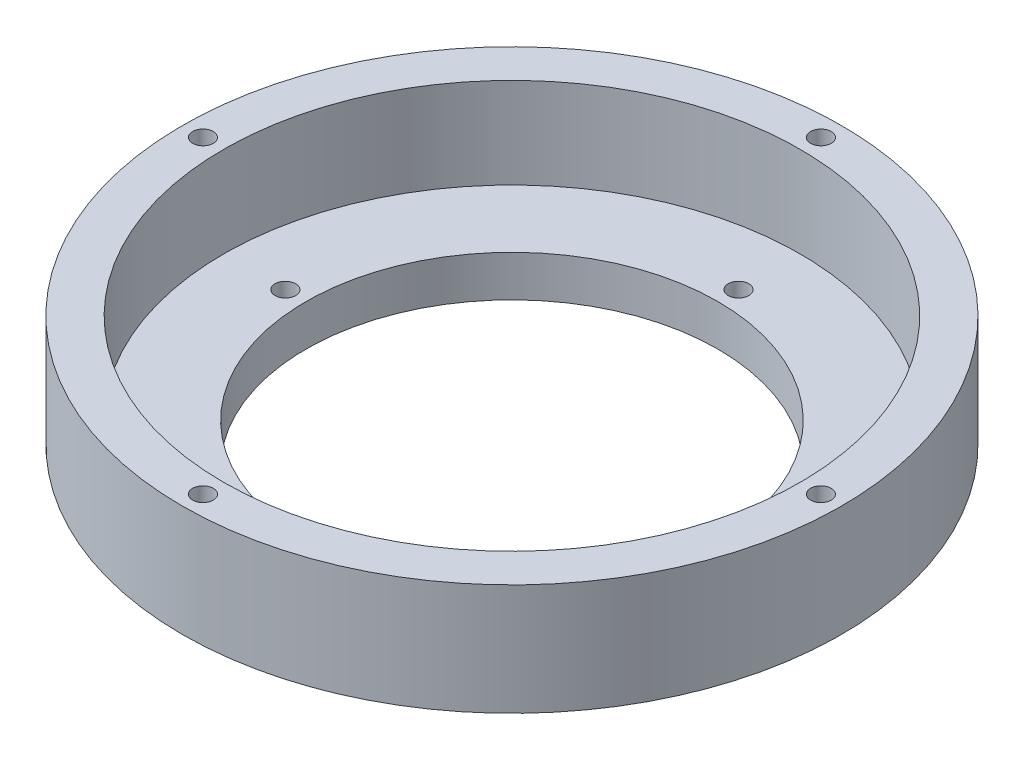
SolidWorks part; units mm, degrees
ref_plane "Front Plane" through (0, 0, 0) normal (0, 0, 1) x (1, 0, 0)
ref_plane "Top Plane" through (0, 0, 0) normal (0, 1, 0) x (1, 0, 0)
ref_plane "Right Plane" through (0, 0, 0) normal (1, 0, 0) x (0, 0, -1)
sketch "Sketch2" plane through (0, 0, 0) normal (0, 1, 0) x (1, 0, 0)
  circle A0 centre (0, 0) radius 50
  circle A1 centre (0, 0) radius 60
  dimension "D1" = 120
  dimension "D2" = 100
extrude "Boss-Extrude1" add sketch "Sketch2" along normal blind 5
sketch "Sketch7" plane through (0, 5, 0) normal (0, 1, 0) x (1, 0, 0)
  circle A0 centre (0, 0) radius 80
  circle A1 centre (0, 0) radius 50
extrude "Boss-Extrude2" add sketch "Sketch7" along normal blind 5
sketch "Sketch8" plane through (0, 10, 0) normal (0, 1, 0) x (1, 0, 0)
  circle A0 centre (0, 0) radius 80
  circle A1 centre (0, 0) radius 70
extrude "Boss-Extrude3" add sketch "Sketch8" along normal blind 22
sketch "Sketch4" plane through (0, 0, 0) normal (0, -1, 0) x (1, 0, 0)
  circle A0 centre (-55, 0) radius 2.5
  circle A1 centre (0, 55) radius 2.5
  circle A2 centre (0, -55) radius 2.5
  circle A3 centre (55, 0) radius 2.5
  point P0 (-55, 0)
  point P5 (0, 55)
  point P6 (55, 0)
  point P7 (0, -55)
  point P8 (0, 0)
  point P10 (0, 55)
  point P13 (0, -55)
  point P16 (55, 0)
  dimension "D1" = 55
  dimension "D2" = 4
extrude "Cut-Extrude3" cut sketch "Sketch4" against normal up to next
sketch "Sketch9" plane through (0, 32, 0) normal (0, 1, 0) x (1, 0, 0)
  circle A0 centre (0, 0) radius 75 construction
  circle A1 centre (-75, 0) radius 2.5
  circle A2 centre (0, 75) radius 2.5
  circle A3 centre (0, -75) radius 2.5
  circle A4 centre (75, 0) radius 2.5
  point P3 (0, 75)
  point P4 (75, 0)
  point P5 (-75, 0)
  point P6 (0, -75)
  point P11 (0, 75)
  point P14 (0, -75)
  point P17 (75, 0)
extrude "Cut-Extrude4" cut sketch "Sketch9" against normal blind 10
